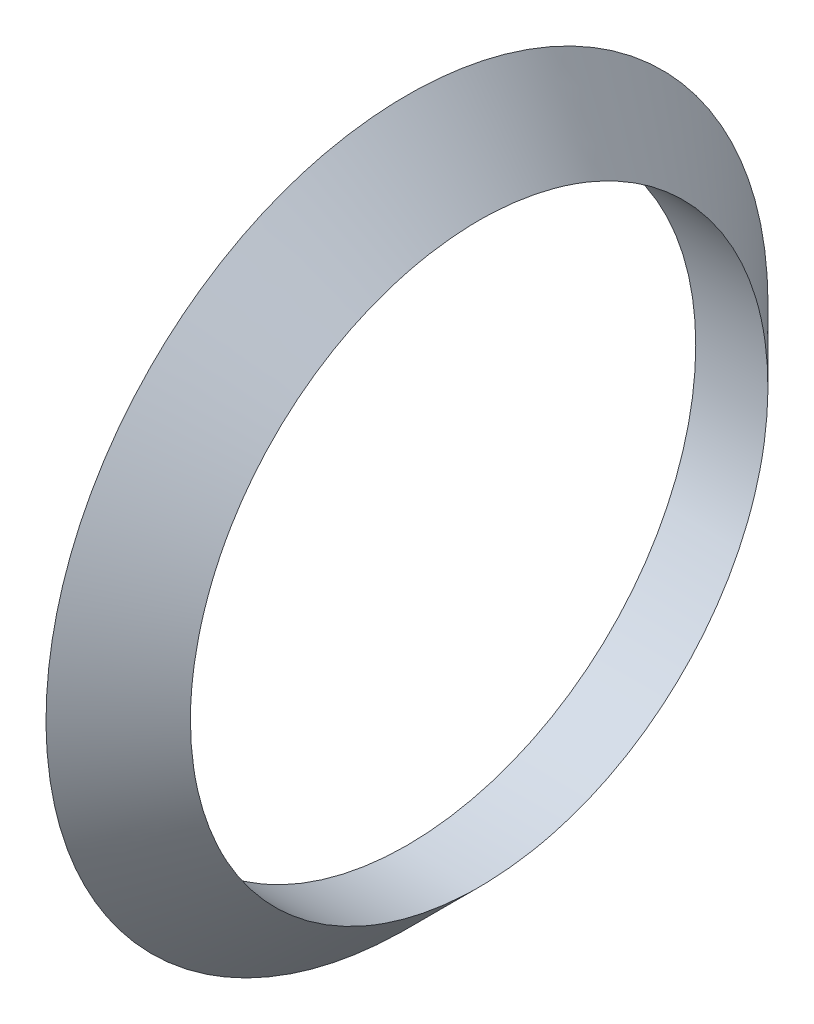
SolidWorks part; units mm, degrees
other "Objet de détail1"
ref_plane "Plan1" through (0, 0, 0) normal (0, 0, 1) x (1, 0, 0)
ref_plane "Plan2" through (0, 0, 0) normal (0, 1, 0) x (1, 0, 0)
ref_plane "Plan3" through (0, 0, 0) normal (1, 0, 0) x (0, 0, -1)
other "Cordon de soudure1"
